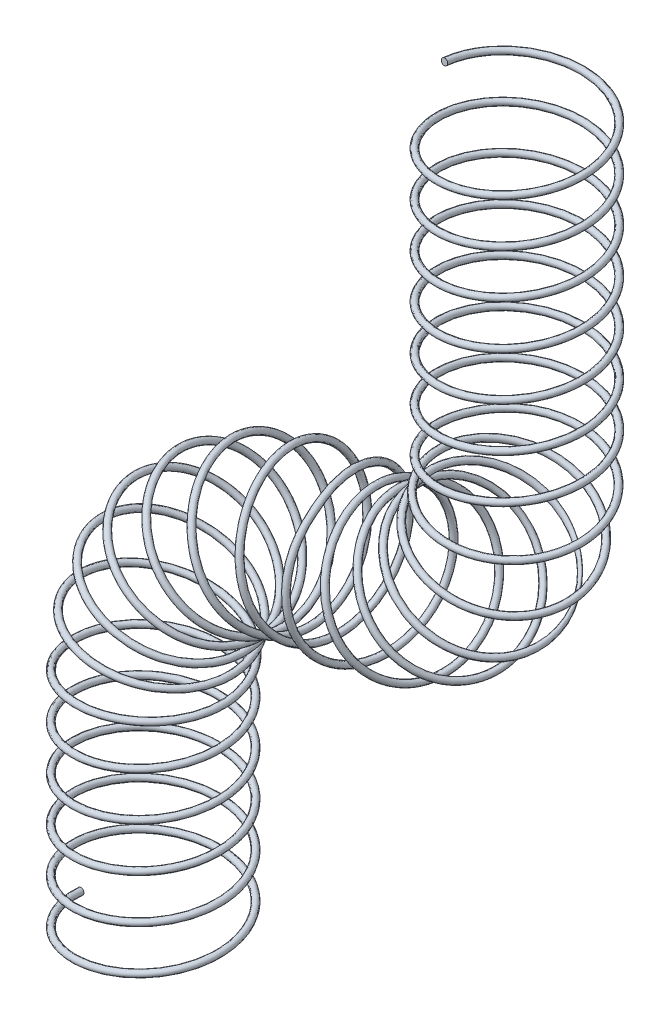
SolidWorks part; units mm, degrees
ref_plane "Front" through (0, 0, 0) normal (0, 0, 1) x (1, 0, 0)
ref_plane "Top" through (0, 0, 0) normal (0, 1, 0) x (1, 0, 0)
ref_plane "Right" through (0, 0, 0) normal (1, 0, 0) x (0, 0, -1)
sketch "Sketch1" plane through (0, 0, 0) normal (0, 0, 1) x (1, 0, 0)
  line L0 (0, 0) -> (0, 12.893)
  line L1 (20.9727, 33.8657) -> (20.9727, 51.9007)
  arc A0 (0, 12.893) -> (11.4502, 24.3432) centre (11.4502, 12.893) cw
  arc A1 (11.4502, 24.3432) -> (20.9727, 33.8657) centre (11.4502, 33.8657) ccw
sketch "Sketch2" plane through (0, 0, 0) normal (0, 0, 1) x (1, 0, 0)
  line L0 (0, 0) -> (-4.1755, 0)
surface "Surface-Sweep1" parameters "D1"=9000
sketch3d "3DSketch1"
  spline S0 degree 3 number of poles 516 (-4.1755, 0, 0) -> (16.7972, 51.9007, 0) construction
  spline S1 degree 3 number of poles 516 (-4.1755, 0, 0) -> (16.7972, 51.9007, 0)
ref_plane "Plane1" through (-4.1755, 0, 0) normal (0, 0.0969, 0.9953) x (1, 0, 0)
sketch "Sketch3" plane through (-4.1755, 0, 0) normal (0, 0.0969, 0.9953) x (1, 0, 0)
  circle A0 centre (0, 0) radius 0.1827
sweep "Sweep1" add profiles "Sketch3" path "3DSketch1"
